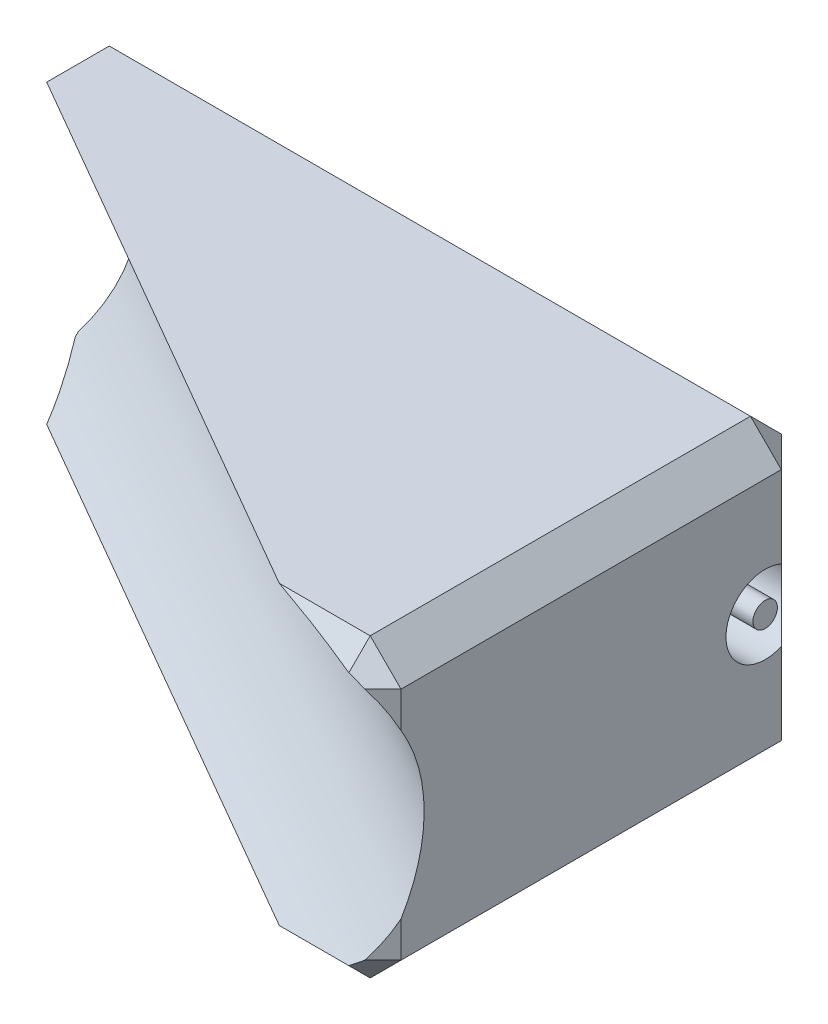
SolidWorks part; units mm, degrees
ref_plane "Front Plane" through (0, 0, 0) normal (0, 0, 1) x (1, 0, 0)
ref_plane "Top Plane" through (0, 0, 0) normal (0, 1, 0) x (1, 0, 0)
ref_plane "Right Plane" through (0, 0, 0) normal (1, 0, 0) x (0, 0, -1)
sketch "Sketch1" plane through (0, 0, 0) normal (0, 1, 0) x (1, 0, 0)
  line L1 (-114, 71.68) -> (114, 71.68)
  line L2 (-114, 71.68) -> (-114, -71.68)
  line L3 (-114, -71.68) -> (114, -71.68)
  line L4 (114, 71.68) -> (114, -71.68)
  line L5 (-114, 71.68) -> (114, -71.68) construction
  line L6 (-114, -71.68) -> (114, 71.68) construction
  point P0 (0, 0)
  dimension "D1" = 228
  dimension "D2" = 143.36
extrude "Boss-Extrude1" add sketch "Sketch1" along normal blind 96.14 contours L4 L3 L2 L1
chamfer "Chamfer1" distance 10 angle 45 12 edges at (0, 96.14, 71.68) (0, 96.14, -71.68) (114, 48.07, 71.68) (114, 96.14, 0) (114, 48.07, -71.68) (0, 0, 71.68) (114, 0, 0) (0, 0, -71.68) (-114, 48.07, -71.68) (-114, 96.14, 0) (-114, 48.07, 71.68) (-114, 0, 0)
ref_point "Point1"
surface "Surface-Offset1" parameters "D1"=0
surface "Surface-Extend2" parameters "D1"=72
split "Split2" trimming surface bodies 103 bodies to split 101 resulting bodies 107 108
delete or keep bodies "Body-Delete/Keep 3" type delete bodies bodies 108
delete or keep bodies "Body-Delete/Keep 4" type delete bodies bodies 103
other "Cavity1"
other "Part3^Assem3<1>@Assem31"
